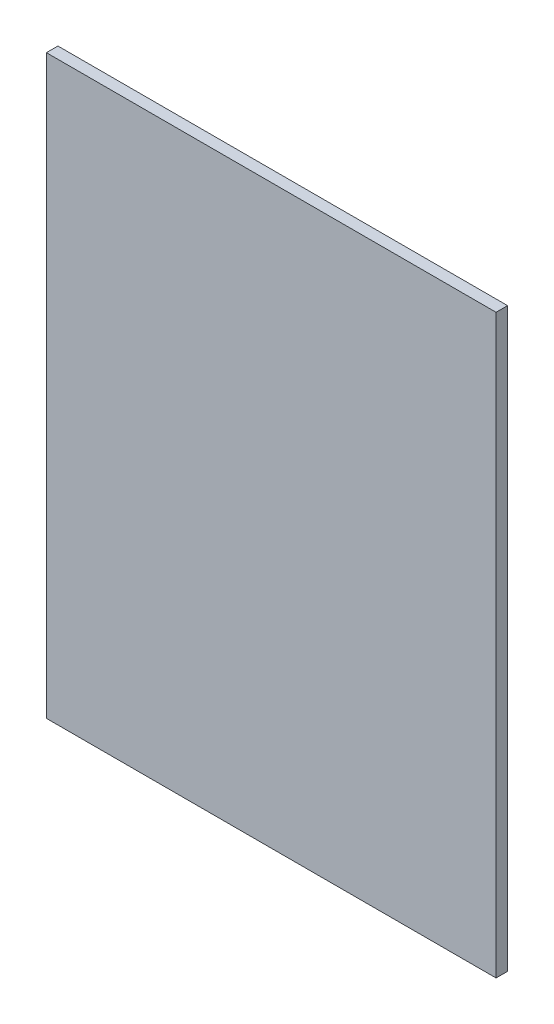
SolidWorks part; units mm, degrees
ref_plane "Alzado" through (0, 0, 0) normal (0, 0, 1) x (1, 0, 0)
ref_plane "Planta" through (0, 0, 0) normal (0, 1, 0) x (1, 0, 0)
ref_plane "Vista lateral" through (0, 0, 0) normal (1, 0, 0) x (0, 0, -1)
sketch "Croquis1" plane through (0, 0, 0) normal (0, 0, 1) x (1, 0, 0)
  line L0 (0, 0) -> (0, 500)
  line L1 (0, 0) -> (-390, 0)
  line L2 (0, 500) -> (-390, 500)
  line L3 (-390, 0) -> (-390, 500)
  point P0 (-367.4916, 0)
extrude "Saliente-Extruir1" add sketch "Croquis1" against normal blind 10
